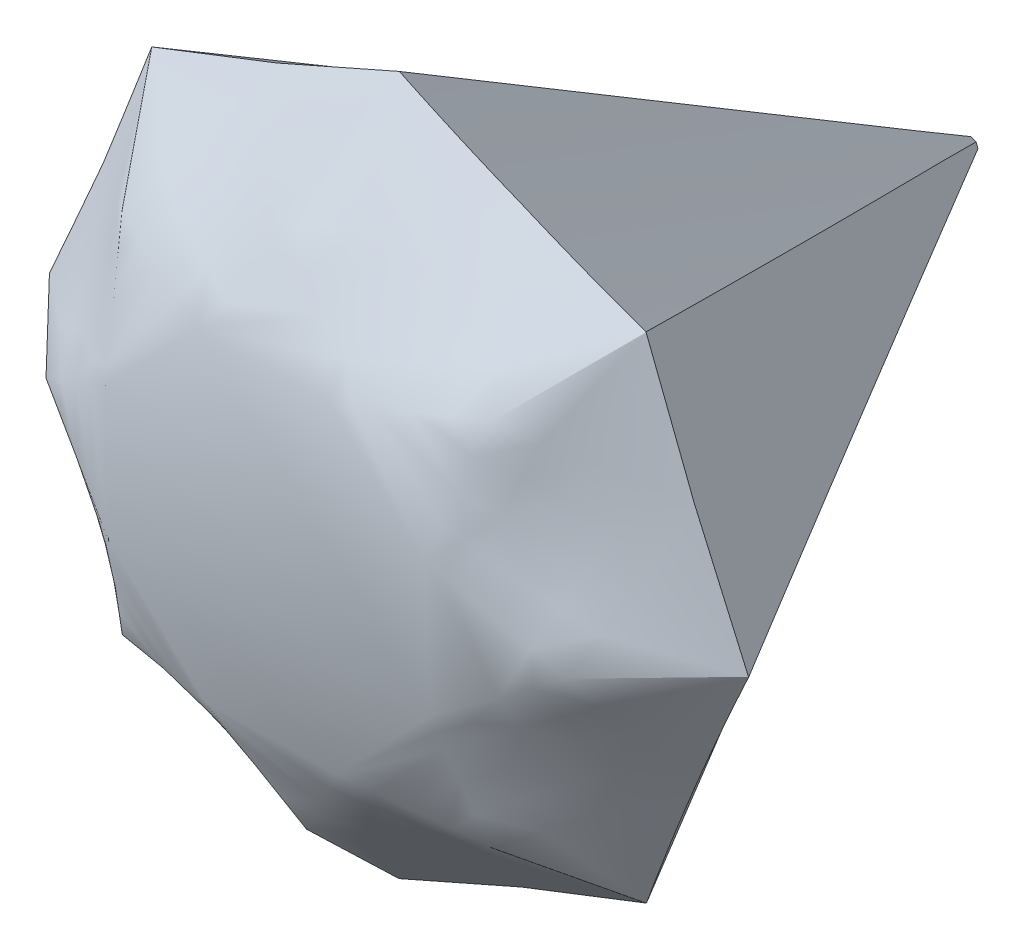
SolidWorks part; units mm, degrees
ref_plane "Front Plane" through (0, 0, 0) normal (0, 0, 1) x (1, 0, 0)
ref_plane "Top Plane" through (0, 0, 0) normal (0, 1, 0) x (1, 0, 0)
ref_plane "Right Plane" through (0, 0, 0) normal (1, 0, 0) x (0, 0, -1)
imported_body "Imported1"
other "Convert Mesh to Standard1"
scale "Scale2" scale about centroid uniform scaling no x scale factor 1 y scale factor 1 z scale factor 1.375
scale "Scale3" scale about centroid uniform scaling yes scale factor 0.0072
scale "Scale4" scale about centroid uniform scaling yes scale factor 2
sketch "Sketch1" plane through (0.0008, 0.0099, 1379.3257) normal (0, 0, -1) x (-1, 0, 0)
  line L0 (-2540.3951, 2539.9939) -> (-2539.6023, 2539.9853) construction
  line L1 (-2539.9943, 2540.386) -> (-2540.003, 2539.5932) construction
  point P8 (-2539.9987, 2539.9896)
